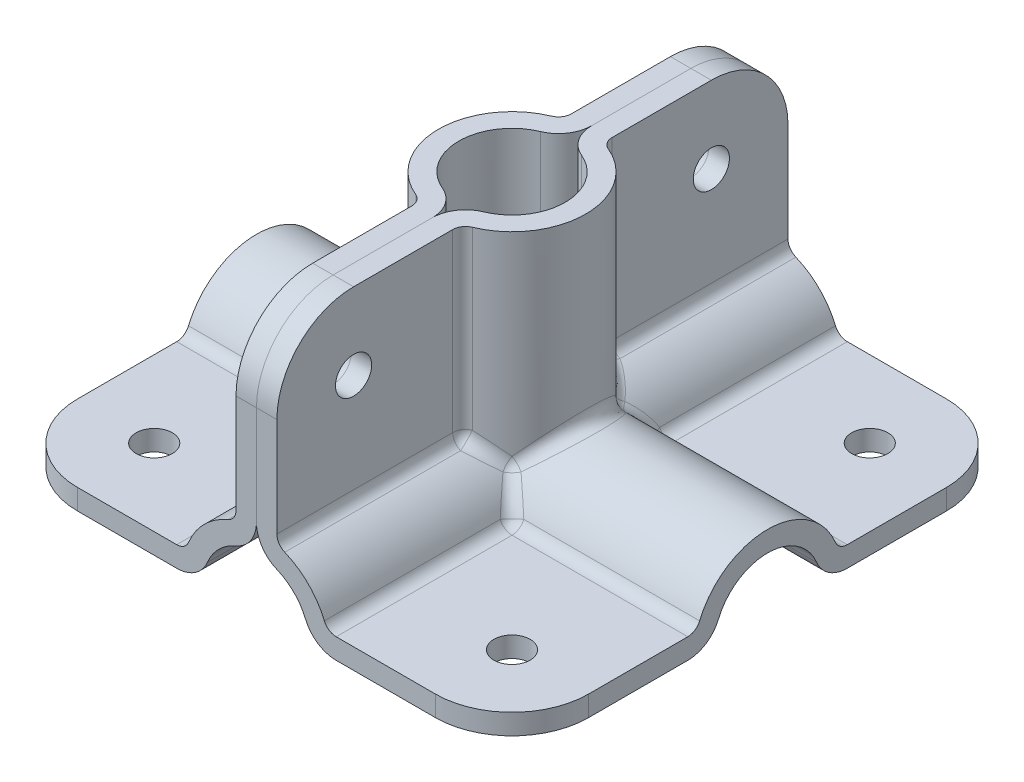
SolidWorks part; units mm, degrees
ref_plane "Front Plane" through (0, 0, 0) normal (0, 0, 1) x (1, 0, 0)
ref_plane "Top Plane" through (0, 0, 0) normal (0, 1, 0) x (1, 0, 0)
ref_plane "Right Plane" through (0, 0, 0) normal (1, 0, 0) x (0, 0, -1)
imported_body "DRP-002-0100-00-1-solid1"
imported_body "DRP-002-0100-00-2-solid1"
delete or keep bodies "Body-Delete1" type delete bodies bodies 101
mirror "Mirror1" about plane through (0, 0, 0) normal (1, 0, 0)
